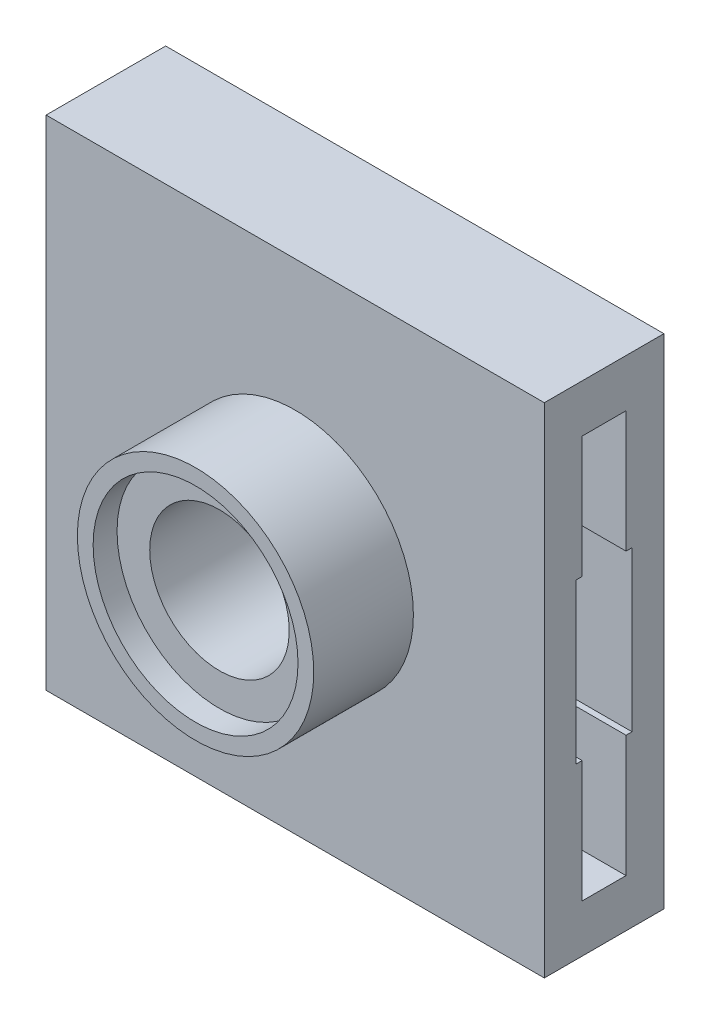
SolidWorks part; units mm, degrees
ref_plane "Front Plane" through (0, 0, 0) normal (0, 0, 1) x (1, 0, 0)
ref_plane "Top Plane" through (0, 0, 0) normal (0, 1, 0) x (1, 0, 0)
ref_plane "Right Plane" through (0, 0, 0) normal (1, 0, 0) x (0, 0, -1)
sketch "Sketch2" plane through (0, 0, 0) normal (0, 0, 1) x (1, 0, 0)
  line L1 (6.25, -6.25) -> (-6.25, -6.25)
  line L2 (6.25, -6.25) -> (6.25, 6.25)
  line L3 (6.25, 6.25) -> (-6.25, 6.25)
  line L4 (-6.25, -6.25) -> (-6.25, 6.25)
  line L5 (6.25, -6.25) -> (-6.25, 6.25) construction
  line L6 (6.25, 6.25) -> (-6.25, -6.25) construction
  point P0 (0, 0)
  dimension "D1" = 12.5
  dimension "D2" = 12.5
extrude "Boss-Extrude1" add sketch "Sketch2" along normal blind 3
sketch "Sketch3" plane through (0, 0, 0) normal (0, 0, 1) x (1, 0, 0)
  circle A0 centre (0, 0) radius 2.965
  circle A1 centre (0, 0) radius 1.75
  dimension "D1" = 5.93
  dimension "D2" = 3.5
extrude "Boss-Extrude2" add sketch "Sketch3" against normal blind 2.5
sketch "Sketch4" plane through (0, 0, 0) normal (0, 0, 1) x (1, 0, 0)
  circle A0 centre (0, 0) radius 1.75
  dimension "D1" = 3.5
ref_plane "Plane2" through (0, 0, 1.5) normal (0, 0, 1) x (1, 0, 0)
extrude "Cut-Extrude1" cut sketch "Sketch4" along normal blind 1.5
mirror "Mirror2" about plane through (0, 0, 1.5) normal (0, 0, 1) of "Boss-Extrude2", "Cut-Extrude1"
sketch "Sketch12" plane through (0, 0, 1.5) normal (0, 0, 1) x (1, 0, 0)
  line L0 (6.25, -6.25) -> (6.25, 6.25) construction
  line L1 (-5.05, 5.05) -> (6.25, 5.05)
  line L2 (-5.05, 5.05) -> (-5.05, -5.05)
  line L3 (-5.05, -5.05) -> (6.25, -5.05)
  line L4 (6.25, 5.05) -> (6.25, -5.05)
  line L5 (6.25, 6.25) -> (-6.25, 6.25) construction
  line L6 (-6.25, 6.25) -> (-6.25, -6.25) construction
  line L7 (-6.25, -6.25) -> (6.25, -6.25) construction
  dimension "D1" = 1.2
  dimension "D2" = 1.2
  dimension "D3" = 1.2
extrude "Cut-Extrude3" cut sketch "Sketch12" against normal blind 0.55 and the other way blind 0.55
sketch "Sketch14" plane through (0, 0, 1.5) normal (0, 0, 1) x (1, 0, 0)
  line L0 (6.25, -6.25) -> (6.25, 6.25) construction
  line L1 (6.25, 2) -> (-3.25, 2)
  line L2 (6.25, 2) -> (6.25, -2)
  line L3 (6.25, -2) -> (-3.25, -2)
  line L4 (-3.25, 2) -> (-3.25, -2)
  line L5 (6.25, 6.25) -> (-6.25, 6.25) construction
  line L6 (-6.25, -6.25) -> (6.25, -6.25) construction
  line L7 (-6.25, 6.25) -> (-6.25, -6.25) construction
  dimension "D1" = 4.25
  dimension "D2" = 4.25
  dimension "D3" = 3
extrude "Cut-Extrude4" cut sketch "Sketch14" against normal blind 0.7 and the other way blind 0.7
ref_plane "Plane3" through (-6.25, 0, 0) normal (1, 0, 0) x (0, 0, -1)
sketch "Sketch15" plane through (-6.25, 0, 0) normal (1, 0, 0) x (0, 0, -1)
  line L0 (-1.5, 6.875) -> (-1.5, -6.875) construction
  line L1 (-2.05, 3.5) -> (-0.95, 3.5)
  line L2 (-2.05, 3.5) -> (-2.05, -3.5)
  line L3 (-2.05, -3.5) -> (-0.95, -3.5)
  line L4 (-0.95, 3.5) -> (-0.95, -3.5)
  line L5 (-2.05, 3.5) -> (-0.95, -3.5) construction
  line L6 (-2.05, -3.5) -> (-0.95, 3.5) construction
  point P0 (-1.5, 0)
  dimension "D1" = 1.1
  dimension "D2" = 7
extrude "Cut-Extrude5" cut sketch "Sketch15" along normal blind 1.2
ref_plane "Plane4" through (0, 0, -2.5) normal (0, 0, 1) x (1, 0, 0)
sketch "Sketch16" plane through (0, 0, -2.5) normal (0, 0, 1) x (1, 0, 0)
  circle A0 centre (0, 0) radius 2.57
  dimension "D1" = 5.14
sketch "Sketch17" plane through (0, 0, -2.5) normal (0, 0, 1) x (1, 0, 0)
  circle A0 centre (0, 0) radius 2.57
extrude "Cut-Extrude6" cut sketch "Sketch17" along normal blind 0.6
mirror "Mirror3" about plane through (0, 0, 1.5) normal (0, 0, 1) of "Cut-Extrude6"
